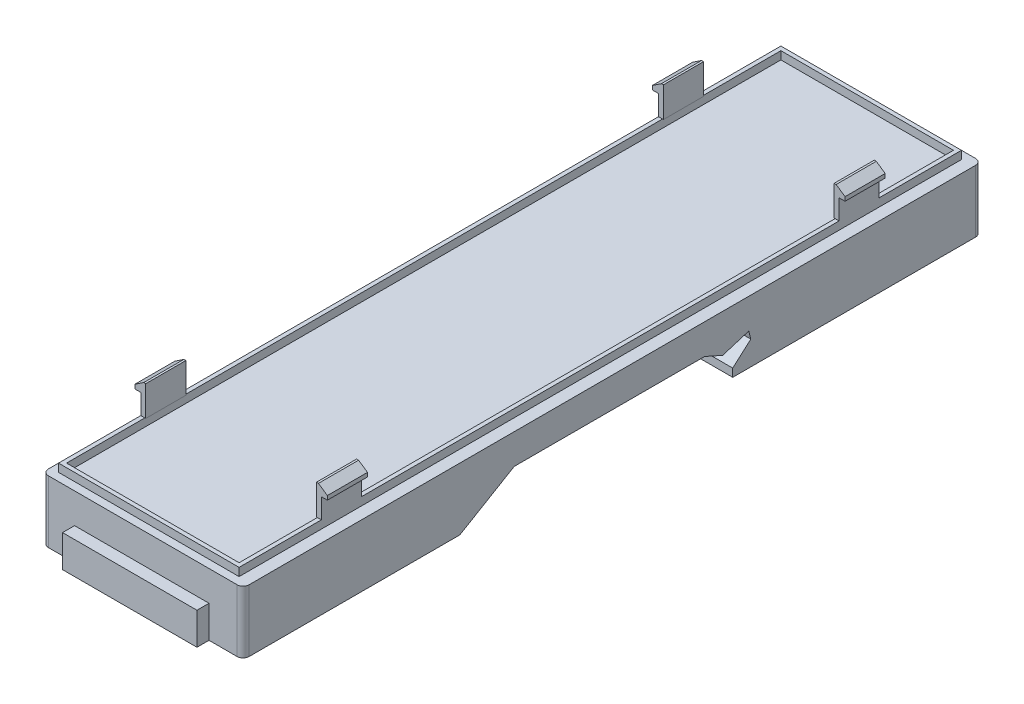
SolidWorks part; units mm, degrees
ref_plane "Front" through (0, 0, 0) normal (0, 0, 1) x (1, 0, 0)
ref_plane "Top" through (0, 0, 0) normal (0, 1, 0) x (1, 0, 0)
ref_plane "Right" through (0, 0, 0) normal (1, 0, 0) x (0, 0, -1)
sketch "Skizze1" plane through (0, 0, 0) normal (1, 0, 0) x (0, 0, -1)
  line L1 (-19.5, 0) -> (-46.5, 0)
  line L2 (-46.5, 0) -> (-46.5, 7.75)
  line L3 (-46.5, 7.75) -> (45.5, 7.75)
  line L4 (45.5, 7.75) -> (45.5, 0)
  line L5 (45.5, 0) -> (14.5, 0)
  line L6 (-12.7241, 4) -> (11, 4)
  line L7 (-19.5, 0) -> (-12.7241, 4)
  line L8 (14.5, 0) -> (14.5, 1)
  line L12 (14.5, 1) -> (16.75, 3)
  line L15 (16.5, 4) -> (16.75, 3)
  line L18 (13.25, 3) -> (16.5, 4)
  line L20 (11, 4) -> (13.25, 3)
extrude "Aufsatz-Linear austragen2" add sketch "Skizze1" along normal blind 25
ref_plane "Ebene1" through (0, 0, 46.5) normal (0, 0, 1) x (1, 0, 0)
sketch "Skizze2" plane through (0, 0, 46.5) normal (0, 0, 1) x (1, 0, 0)
  line L0 (25, 0) -> (0, 0) construction
  line L1 (3, 7) -> (21.75, 7)
  line L2 (3, 7) -> (3, 0)
  line L3 (3, 0) -> (21.75, 0)
  line L4 (21.75, 7) -> (21.75, 0)
  line L6 (4, 4) -> (20.75, 4)
  line L7 (4, 4) -> (4, 0)
  line L8 (4, 0) -> (20.75, 0)
  line L9 (20.75, 4) -> (20.75, 0)
extrude "Aufsatz-Linear austragen3" add sketch "Skizze2" along normal blind 1.5 contours L9 L6 L7 L3
fillet "Verrundung1" radius 0.75 4 edges at (0, 3.875, -45.5) (25, 3.875, -45.5) (0, 3.875, 46.5) (25, 3.875, 46.5)
ref_plane "Ebene2" through (0, 7.75, 0) normal (0, 1, 0) x (1, 0, 0)
sketch "Skizze3" plane through (0, 7.75, 0) normal (0, 1, 0) x (1, 0, 0)
  line L1 (1, 44.5) -> (23.5, 44.5)
  line L2 (1, 44.5) -> (1, -45.5)
  line L3 (1, -45.5) -> (23.5, -45.5)
  line L4 (23.5, 44.5) -> (23.5, -45.5)
  line L8 (1.5, 44) -> (1.5, -45)
  line L9 (1.5, -45) -> (23, -45)
  line L10 (23, 44) -> (23, -45)
  line L11 (1.5, 44) -> (23, 44)
extrude "Aufsatz-Linear austragen4" add sketch "Skizze3" along normal blind 1 contours L2 L3 L4 L1 | L8 L9 L10 L11
ref_plane "Ebene3" through (0, 0, 45.5) normal (0, 0, 1) x (1, 0, 0)
sketch "Skizze4" plane through (0, 0, 45.5) normal (0, 0, 1) x (1, 0, 0)
  line L0 (22.882, 8.75) -> (22.882, 12.5)
  line L1 (1, 8.75) -> (23.5, 8.75) construction
  line L2 (23.5, 8.75) -> (23.5, 11.25)
  line L3 (23.5, 11.25) -> (24.25, 11.25)
  line L7 (12.25, 8.75) -> (12.25, 0) construction
  line L12 (1, 8.75) -> (1, 11.25)
  line L13 (1.618, 8.75) -> (1.618, 12.5)
  line L14 (1, 8.75) -> (1.618, 8.75)
  line L15 (22.882, 8.75) -> (23.5, 8.75)
  line L17 (1, 11.25) -> (0.25, 11.25)
  line L18 (0.25, 11.25) -> (0.25, 11.75)
  line L20 (24.25, 11.25) -> (24.25, 11.75)
  line L23 (1.618, 12.5) -> (1.368, 12.5)
  line L24 (1.368, 12.5) -> (0.25, 11.75)
  line L25 (22.882, 12.5) -> (23.132, 12.5)
  line L26 (23.132, 12.5) -> (24.25, 11.75)
extrude "Aufsatz-Linear austragen11" add sketch "Skizze4" against normal blind 5 from offset 10.25
pattern_linear "Lineares Muster3" count 2 spacing 64.5 along (0, 0, -1) of "Aufsatz-Linear austragen11"
